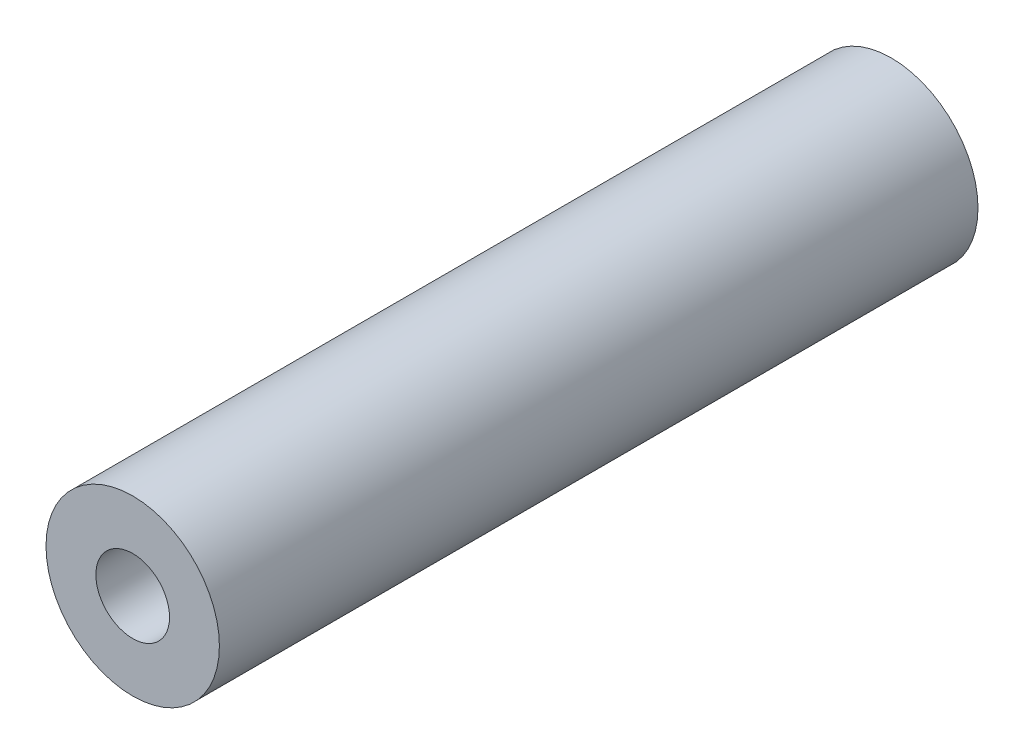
SolidWorks part; units mm, degrees
ref_plane "前视基准面" through (0, 0, 0) normal (0, 0, 1) x (1, 0, 0)
ref_plane "上视基准面" through (0, 0, 0) normal (0, 1, 0) x (1, 0, 0)
ref_plane "右视基准面" through (0, 0, 0) normal (1, 0, 0) x (0, 0, -1)
other "Configuration Table"
sketch "草图1" plane through (0, 0, 0) normal (0, 0, 1) x (1, 0, 0)
  circle A0 centre (0, 0) radius 4
  circle A1 centre (0, 0) radius 1.7
  dimension "D1" = 3.4
  dimension "D2" = 8
extrude "M3_clearance_standoff" add sketch "草图1" along normal blind 35
